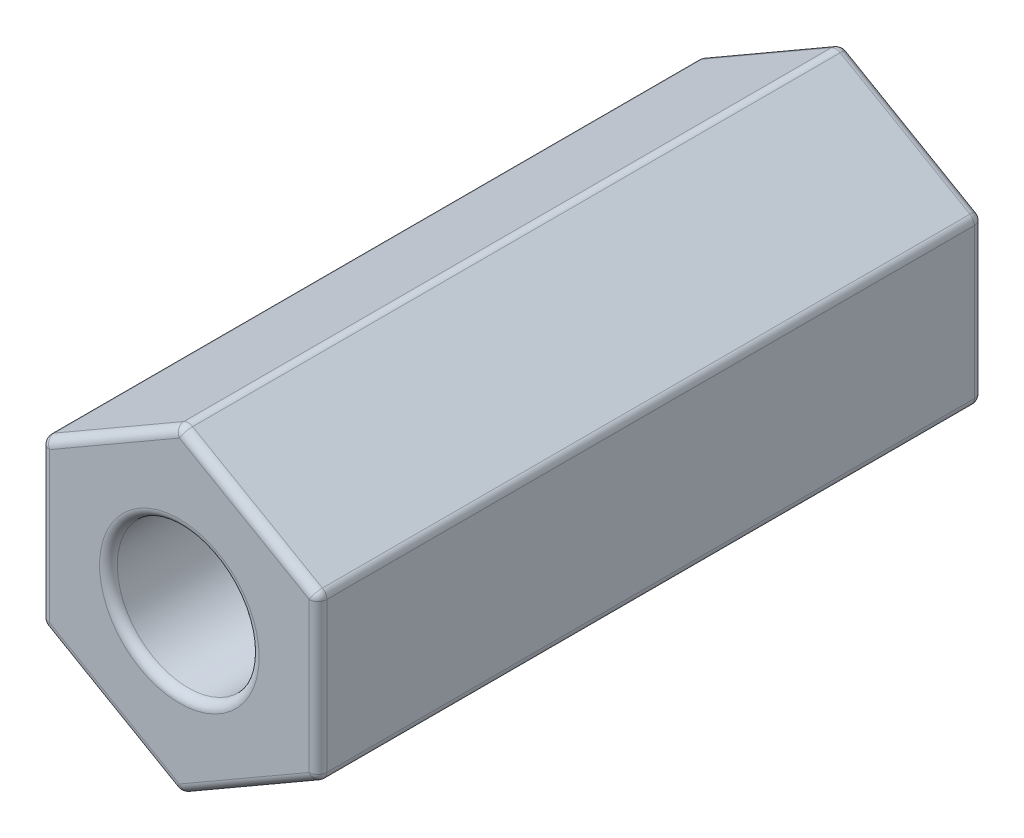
SolidWorks part; units mm, degrees
ref_plane "Front Plane" through (0, 0, 0) normal (0, 0, 1) x (1, 0, 0)
ref_plane "Top Plane" through (0, 0, 0) normal (0, 1, 0) x (1, 0, 0)
ref_plane "Right Plane" through (0, 0, 0) normal (1, 0, 0) x (0, 0, -1)
sketch "Sketch1" plane through (0, 0, 0) normal (0, 0, 1) x (1, 0, 0)
  line L0 (0, 0) -> (0, 4.5827) construction
  line L1 (0, 0) -> (0, -4.5827) construction
  line L2 (0, 0) -> (3.9687, 2.2914) construction
  line L3 (0, 0) -> (3.9688, -2.2914) construction
  line L4 (0, 0) -> (-3.9688, 2.2914) construction
  line L5 (0, 0) -> (-3.9687, -2.2914) construction
  line L6 (0, 4.5827) -> (-3.9688, 2.2914)
  line L7 (-3.9688, 2.2914) -> (-3.9687, -2.2914)
  line L8 (-3.9687, -2.2914) -> (0, -4.5827)
  line L9 (0, -4.5827) -> (3.9688, -2.2914)
  line L10 (3.9688, -2.2914) -> (3.9687, 2.2914)
  line L11 (3.9687, 2.2914) -> (0, 4.5827)
  circle A0 centre (0, 0) radius 2.032
  dimension "D1" = 60
  dimension "D2" = 60
  dimension "D3" = 60
  dimension "D4" = 60
  dimension "D5" = 7.9375
  dimension "D6" = 7.9375
  dimension "D7" = 7.9375
  dimension "D8" = 7.9375
  dimension "D9" = 7.9375
  dimension "D10" = 7.9375
extrude "Extrude1" add sketch "Sketch1" against normal blind 19.05
fillet "Fillet1" radius 0.254 20 edges at (1.9844, 3.437, -19.05) (-1.9844, 3.437, -19.05) (-3.9687, 0, -19.05) (-1.9844, -3.437, -19.05) (1.9844, -3.437, -19.05) (3.9688, 0, -19.05) (2.032, 0, -19.05) (3.9688, 0, 0) (1.9844, -3.437, 0) (-1.9844, -3.437, 0) (-3.9687, 0, 0) (-1.9844, 3.437, 0) (1.9844, 3.437, 0) (2.032, 0, 0) (-3.9687, -2.2914, -9.525) (0, -4.5827, -9.525) (-3.9688, 2.2914, -9.525) (3.9688, -2.2914, -9.525) (3.9687, 2.2914, -9.525) (0, 4.5827, -9.525)
